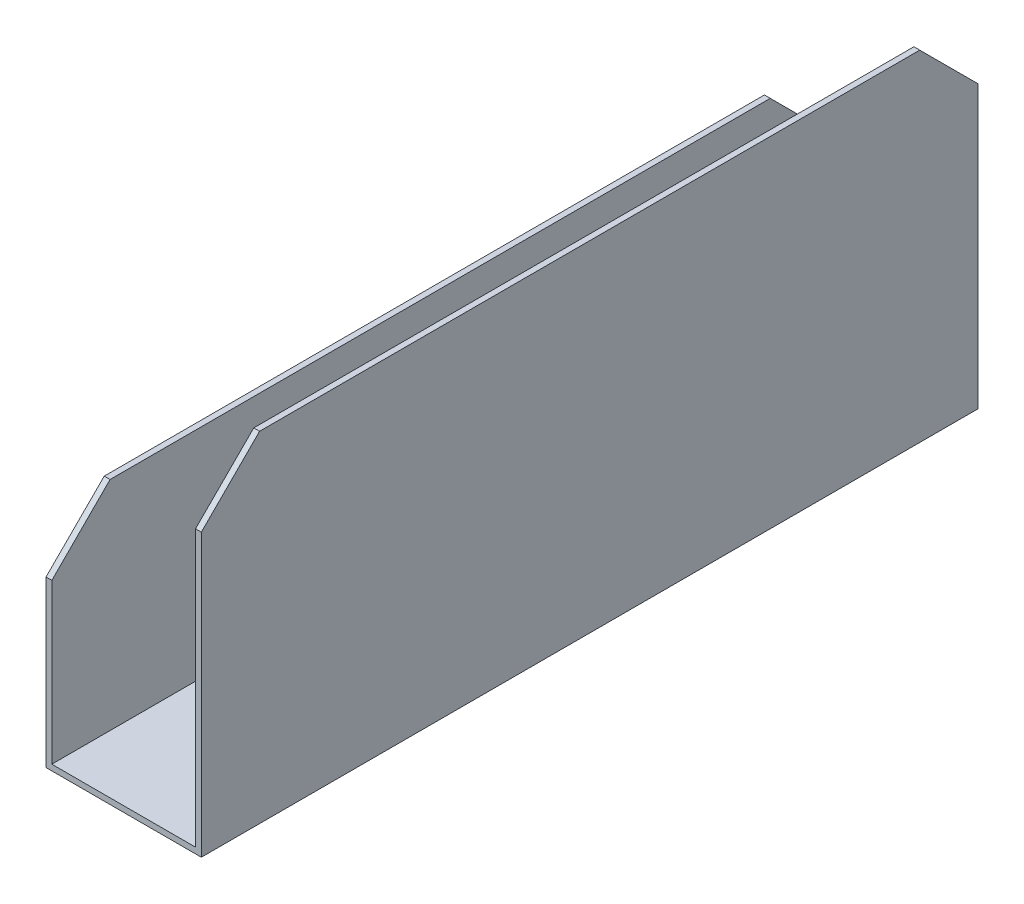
SolidWorks part; units mm, degrees
ref_plane "Plan de face" through (0, 0, 0) normal (0, 0, 1) x (1, 0, 0)
ref_plane "Plan de dessus" through (0, 0, 0) normal (0, 1, 0) x (1, 0, 0)
ref_plane "Plan de droite" through (0, 0, 0) normal (1, 0, 0) x (0, 0, -1)
sketch "Esquisse1" plane through (0, 0, 0) normal (0, 0, 1) x (1, 0, 0)
  line L0 (0, 56) -> (0, 0)
  line L1 (0, 0) -> (37, 0)
  line L2 (37, 0) -> (37, 86)
  line L3 (-1.5, 56) -> (-1.5, -1.5)
  line L4 (-1.5, -1.5) -> (38.5, -1.5)
  line L5 (38.5, -1.5) -> (38.5, 86)
  line L6 (0, 56) -> (-1.5, 56)
  line L7 (38.5, 86) -> (37, 86)
  dimension "D2" = 40
  dimension "D3" = 87.5
  dimension "D4" = 57.5
  dimension "D1" = 1.5
extrude "Extrusion1" add sketch "Esquisse1" along normal blind 200
chamfer "Chanfrein1" distance 15 distance2 15 4 edges at (-0.75, 56, 0) (37.75, 86, 0) (37.75, 86, 200) (-0.75, 56, 200)
